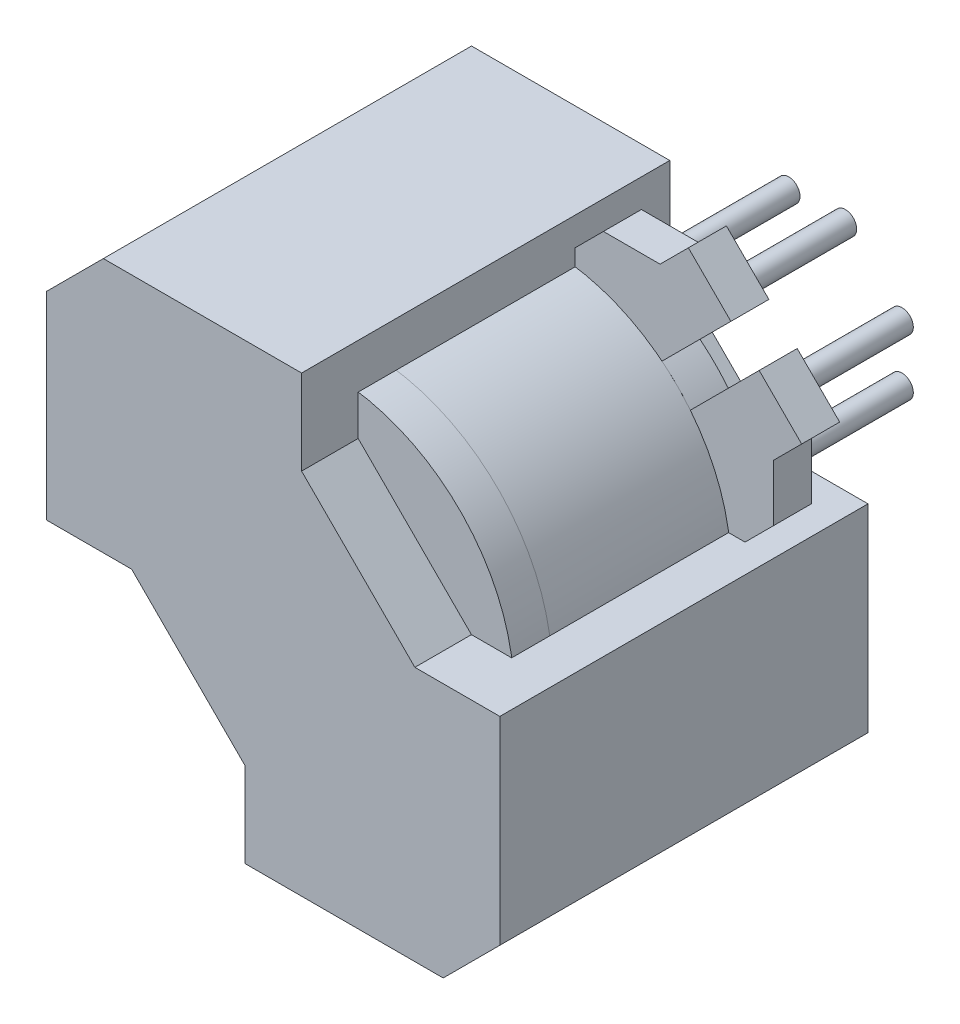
SolidWorks part; units mm, degrees
ref_plane "Front Plane" through (0, 0, 0) normal (0, 0, 1) x (1, 0, 0)
ref_plane "Top Plane" through (0, 0, 0) normal (0, 1, 0) x (1, 0, 0)
ref_plane "Right Plane" through (0, 0, 0) normal (1, 0, 0) x (0, 0, -1)
sketch "Sketch1" plane through (0, 0, 0) normal (0, 0, 1) x (1, 0, 0)
  circle A0 centre (0, 0) radius 8.255
extrude "Boss-Extrude1" add sketch "Sketch1" along normal blind 1.7018
sketch "Sketch2" plane through (0, 0, 0) normal (0, 0, -1) x (-1, 0, 0)
  line L0 (5.08, -10.16) -> (6.35, -11.43)
  line L1 (9.525, -8.255) -> (4.445, -3.175)
  line L2 (8.255, -9.525) -> (3.175, -4.445)
  line L3 (4.445, -3.175) -> (3.175, -4.445)
  line L4 (11.43, -6.35) -> (9.525, -8.255)
  line L5 (8.255, -9.525) -> (6.35, -11.43)
  line L6 (11.43, -6.35) -> (10.16, -5.08)
  line L7 (5.08, -10.16) -> (2.54, -10.16)
  line L8 (2.54, -10.16) -> (-10.16, 2.54)
  line L9 (-10.16, 2.54) -> (-10.16, 5.08)
  line L10 (-10.16, 5.08) -> (-11.43, 6.35)
  line L11 (-6.35, 11.43) -> (-8.255, 9.525)
  line L12 (-6.35, 11.43) -> (-5.08, 10.16)
  line L13 (-5.08, 10.16) -> (-2.54, 10.16)
  line L14 (-2.54, 10.16) -> (10.16, -2.54)
  line L15 (10.16, -2.54) -> (10.16, -5.08)
  line L16 (-8.255, 9.525) -> (-3.175, 4.445)
  line L17 (-9.525, 8.255) -> (-4.445, 3.175)
  line L18 (-3.175, 4.445) -> (-4.445, 3.175)
  line L19 (-9.525, 8.255) -> (-11.43, 6.35)
extrude "Boss-Extrude2" add sketch "Sketch2" along normal blind 0.0025 and the other way blind 1.7018
sketch "Sketch3" plane through (0, 0, -0.0025) normal (0, 0, -1) x (-1, 0, 0)
  circle A0 centre (6.35, -8.89) radius 0.508
  circle A1 centre (3.81, -8.89) radius 0.508
  circle A2 centre (3.81, -6.35) radius 0.508
  circle A3 centre (8.89, -6.35) radius 0.508
  circle A4 centre (8.89, -3.81) radius 0.508
  circle A5 centre (6.35, -3.81) radius 0.508
  circle A6 centre (-6.35, 8.89) radius 0.508
  circle A7 centre (-3.81, 6.35) radius 0.508
  circle A8 centre (-3.81, 8.89) radius 0.508
  circle A9 centre (-8.89, 6.35) radius 0.508
  circle A10 centre (-8.89, 3.81) radius 0.508
  circle A11 centre (-6.35, 3.81) radius 0.508
extrude "Boss-Extrude3" add sketch "Sketch3" along normal blind 5.334 separate body
sketch "Sketch4" plane through (0, 0, -0.0025) normal (0, 0, -1) x (-1, 0, 0)
  line L0 (1.27, -10.16) -> (-7.62, -10.16)
  line L1 (-7.62, -10.16) -> (-10.16, -7.62)
  line L2 (-10.16, -7.62) -> (-10.16, 1.27)
  line L3 (-10.16, 1.27) -> (-6.35, 1.27)
  line L4 (-6.35, 1.27) -> (-1.27, 6.35)
  line L5 (-1.27, 6.35) -> (-1.27, 10.16)
  line L6 (-1.27, 10.16) -> (7.62, 10.16)
  line L7 (7.62, 10.16) -> (10.16, 7.62)
  line L8 (10.16, 7.62) -> (10.16, -1.27)
  line L9 (10.16, -1.27) -> (6.35, -1.27)
  line L10 (6.35, -1.27) -> (1.27, -6.35)
  line L11 (1.27, -6.35) -> (1.27, -10.16)
extrude "Boss-Extrude4" add sketch "Sketch4" along normal blind 2.54 and the other way blind 13.97 separate body
sketch "Sketch5" plane through (0, 0, 1.7018) normal (0, 0, 1) x (1, 0, 0)
  circle A0 centre (0, 0) radius 8.255
extrude "Boss-Extrude5" add sketch "Sketch5" along normal blind 8.0264 separate body
sketch "Sketch6" plane through (0, 0, 9.7282) normal (0, 0, 1) x (1, 0, 0)
  circle A0 centre (0, 0) radius 8.255
extrude "Boss-Extrude6" add sketch "Sketch6" along normal blind 1.7018 separate body
